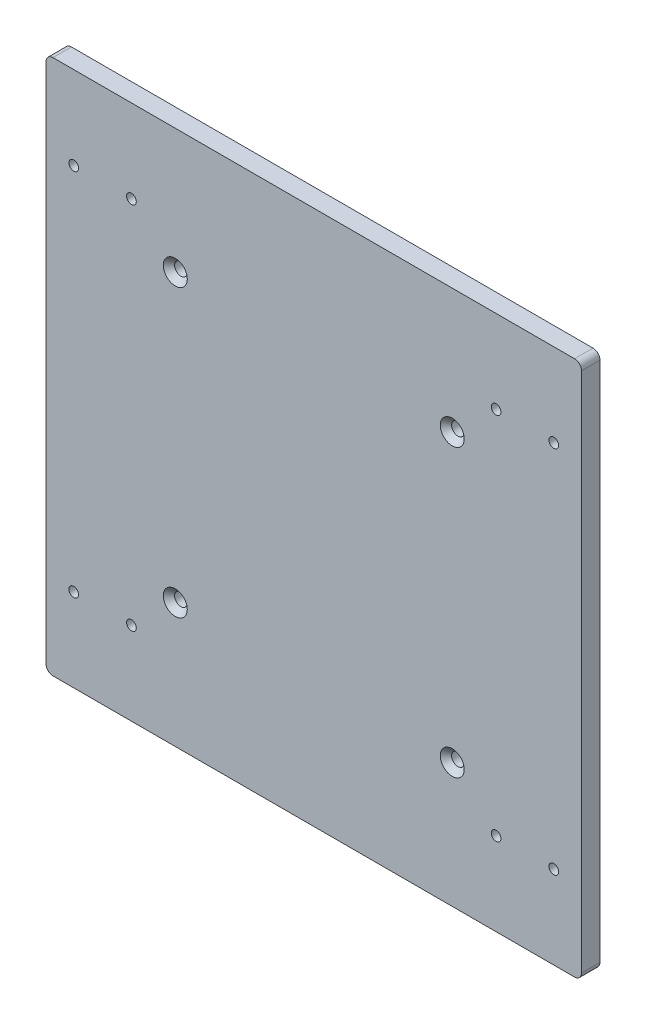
SolidWorks part; units mm, degrees
ref_plane "Przednia" through (0, 0, 0) normal (0, 0, 1) x (1, 0, 0)
ref_plane "Górna" through (0, 0, 0) normal (0, 1, 0) x (1, 0, 0)
ref_plane "Prawa" through (0, 0, 0) normal (1, 0, 0) x (0, 0, -1)
sketch "Szkic1" plane through (0, 0, 0) normal (0, 0, 1) x (1, 0, 0)
  line L0 (0, 116) -> (0, 0) construction
  line L1 (-116, 116) -> (116, 116)
  line L2 (-116, 116) -> (-116, -116)
  line L3 (-116, -116) -> (116, -116)
  line L4 (116, 116) -> (116, -116)
  line L5 (0, 0) -> (-116, 0) construction
  dimension "D1" = 232
  dimension "D2" = 232
extrude "Dodanie-wyciągnięcie1" add sketch "Szkic1" along normal blind 8
sketch "Szkic2" plane through (0, 0, 8) normal (0, 0, 1) x (1, 0, 0)
  line L0 (0, 100) -> (0, 0) construction
  line L1 (-80, -100) -> (80, -100)
  line L2 (-80, -100) -> (-80, 100)
  line L3 (-80, 100) -> (80, 100)
  line L4 (80, -100) -> (80, 100)
  line L5 (0, 0) -> (80, 0) construction
  dimension "D1" = 200
  dimension "D2" = 160
extrude "Wytnij-wyciągnięcie1" [suppressed] cut sketch "Szkic2" against normal blind 1
hole_wizard "Otwór gwintowany M4x0.71" positions "Szkic4" profile "Szkic3" tap size "M4x0.7" standard "Ansi Metric"
sketch "Szkic4" plane through (0, 0, 8) normal (0, 0, 1) x (1, 0, 0)
  line L1 (-85.5, 90) -> (85.5, 90)
  line L2 (-85.5, 90) -> (-85.5, -90)
  line L3 (-85.5, -90) -> (85.5, -90)
  line L4 (85.5, 90) -> (85.5, -90)
  line L5 (-85.5, 0) -> (0, 0) construction
  line L6 (0, 0) -> (0, -90) construction
  point P0 (-85.5, 90)
  point P2 (85.5, 90)
  point P4 (85.5, -90)
  point P6 (-85.5, -90)
  dimension "D1" = 171
  dimension "D2" = 180
sketch "Szkic3" plane through (-85.5, 90, 8) normal (1, 0, 0) x (0, -1, 0)
  line L0 (0, 0) -> (0, 12.4914)
  line L1 (0, 12.4914) -> (1.65, 11.5)
  line L2 (1.65, 11.5) -> (1.65, 0)
  line L5 (1.65, 0) -> (0, 0)
  line L10 (0, 12.4914) -> (-1.65, 11.5) construction
  line L11 (0, -6.35) -> (0, 107.95) construction
  dimension "Średnica wiertła gwintu" = 3.3
  dimension "Głębokość otworu gwintowanego" = 11.5
  dimension "Kąt wiertła" = 118
hole_wizard "Pogłębienie stożkowe pod M5 wkręt do części metalowych z łbem soczewkowym1" positions "Szkic6" profile "Szkic5" countersink size "M5" standard "Ansi Metric"
sketch "Szkic6" plane through (0, 0, 8) normal (0, 0, 1) x (1, 0, 0)
  line L1 (-60, -62) -> (60, -62)
  line L2 (-60, -62) -> (-60, 62)
  line L3 (-60, 62) -> (60, 62)
  line L4 (60, -62) -> (60, 62)
  line L5 (0, 0) -> (0, 62) construction
  line L8 (-60, 0) -> (0, 0) construction
  point P0 (60, 62)
  point P3 (-60, -62)
  point P11 (-60, 62)
  point P12 (60, -62)
  dimension "D1" = 124
  dimension "D2" = 120
sketch "Szkic5" plane through (60, 62, 8) normal (1, 0, 0) x (0, -1, 0)
  line L0 (0, 0) -> (0, 8)
  line L1 (0, 8) -> (2.75, 8)
  line L2 (2.75, 8) -> (2.75, 2.45)
  line L3 (2.75, 2.45) -> (5.2, 0)
  line L5 (5.2, 0) -> (0, 0)
  line L6 (-2.75, 2.45) -> (-5.2, 0) construction
  line L11 (0, -6.35) -> (0, 107.95) construction
  dimension "Średnica otworu na wylot" = 5.5
  dimension "Głębokość otworu na wylot" = 8
  dimension "Średnica zewnętrznego pogłębienia stożkowego" = 10.4
  dimension "Kąt zewnętrznego pogłębienia stożkowego" = 90
fillet "Zaokrąglenie1" radius 3 4 edges at (-116, 116, 4) (116, 116, 4) (116, -116, 4) (-116, -116, 4)
hole_wizard "Otwór gwintowany M5x0.81" positions "Szkic8" profile "Szkic7" tap size "M5x0.8" standard "Ansi Metric"
sketch "Szkic8" plane through (0, 0, 0) normal (0, 0, -1) x (-1, 0, 0)
  line L0 (-104, -80) -> (-79, -80)
  line L1 (-104, -80) -> (-104, 80)
  line L2 (-79, -80) -> (-79, 80)
  line L3 (-104, 80) -> (-79, 80)
  line L4 (79, -80) -> (104, -80)
  line L5 (79, -80) -> (79, 80)
  line L6 (104, -80) -> (104, 80)
  line L7 (79, 80) -> (104, 80)
  line L8 (-116, -113) -> (-116, 113) construction
  line L9 (116, 113) -> (116, -113) construction
  line L10 (-116, 0) -> (-104, 0)
  line L13 (116, 0) -> (104, 0)
  point P0 (79, -80)
  point P2 (104, -80)
  point P4 (-79, -80)
  point P6 (-104, -80)
  point P129 (-79, 80)
  point P130 (-104, 80)
  point P240 (104, 80)
  point P241 (79, 80)
  dimension "D1" = 12
  dimension "D2" = 160
  dimension "D3" = 160
  dimension "D4" = 12
  dimension "D5" = 25
  dimension "D6" = 25
sketch "Szkic7" plane through (-79, -80, 0) normal (1, 0, 0) x (0, 1, 0)
  line L0 (0, 0) -> (0, 8)
  line L1 (0, 8) -> (2.1, 8)
  line L2 (2.1, 8) -> (2.1, 0)
  line L5 (2.1, 0) -> (0, 0)
  line L11 (0, -6.35) -> (0, 107.95) construction
  dimension "Średnica otworu gwintowanego na wylot" = 4.2
  dimension "Głębokość otworu gwintowanego na wylot" = 8
